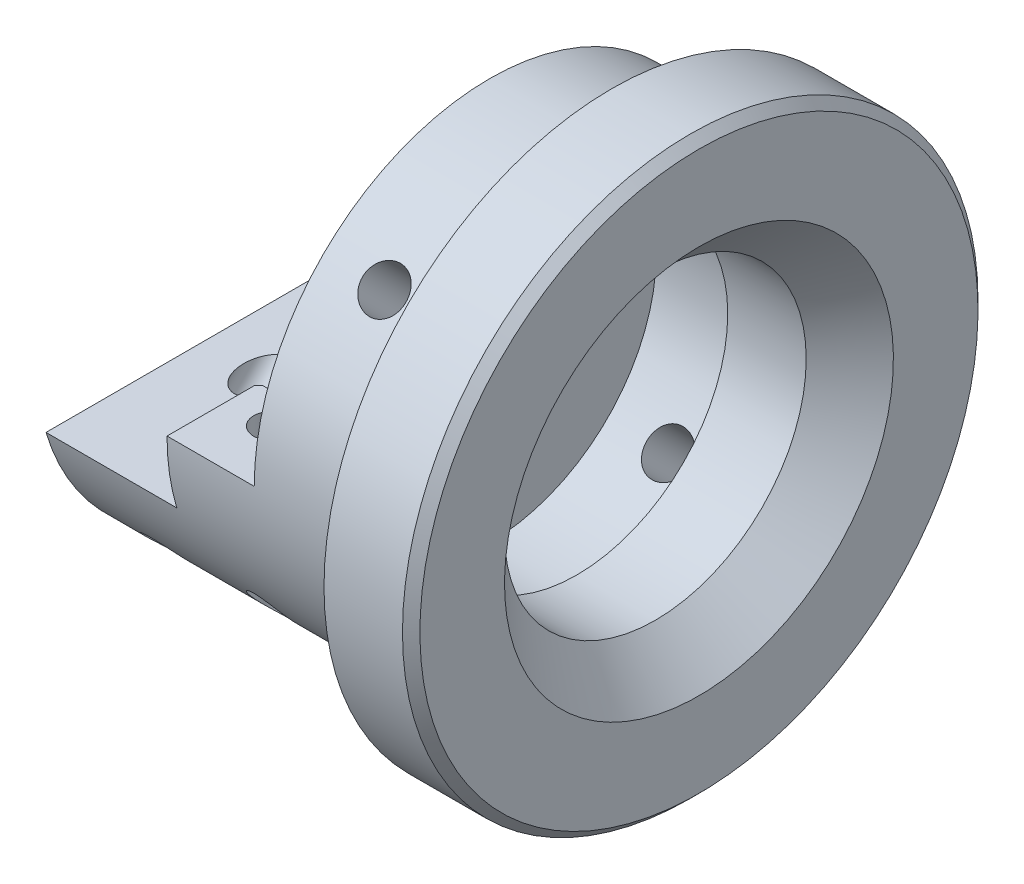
SolidWorks part; units mm, degrees
ref_plane "Vorne" through (0, 0, 0) normal (0, 0, 1) x (1, 0, 0)
ref_plane "Oben" through (0, 0, 0) normal (0, 1, 0) x (1, 0, 0)
ref_plane "Rechts" through (0, 0, 0) normal (1, 0, 0) x (0, 0, -1)
sketch "Skizze1" plane through (0, 0, 0) normal (0, 0, 1) x (1, 0, 0)
  line L0 (139.7, 16.5) -> (144.7, 16.5) construction
  line L1 (139.7, 16.5) -> (139.7, 13.5) construction
  line L2 (81.7, 13.5) -> (139.7, 13.5) construction
  line L3 (144.7, 8.65) -> (132.7, 8.65) construction
  line L4 (144.7, 16.5) -> (144.7, 8.65) construction
  line L5 (132.7, 8.65) -> (132.7, 0) construction
  line L6 (132.7, 0) -> (119.7, 0) construction
  line L9 (119.7, 0) -> (119.7, 13.5) construction
  line L10 (139.7, 16.5) -> (144.7, 16.5)
  line L11 (139.7, 16.5) -> (139.7, 13.5)
  line L12 (119.7, 13.5) -> (139.7, 13.5)
  line L13 (144.7, 8.65) -> (132.7, 8.65)
  line L14 (144.7, 16.5) -> (144.7, 8.65)
  line L15 (132.7, 8.65) -> (132.7, 0)
  line L16 (132.7, 0) -> (119.7, 0)
  line L19 (119.7, 0) -> (119.7, 13.5)
revolve "Rotation1" add sketch "Skizze1" angle 360 about L16
sketch "Skizze20" plane through (0, 0, 0) normal (0, 0, 1) x (1, 0, 0)
  line L0 (119.7, 0) -> (139.7, 0) construction
  line L1 (137.7, 0) -> (132.7, 0)
  line L2 (137.7, 0) -> (137.7, 9.55)
  line L3 (137.7, 9.55) -> (132.7, 9.55)
  line L4 (132.7, 0) -> (132.7, 9.55)
  line L5 (144.7, -16.5) -> (144.7, 16.5) construction
  line L6 (132.7, -8.65) -> (132.7, 8.65) construction
  dimension "D1" = 9.55
  dimension "D2" = 7
revolve "Schnitt-Rotation1" cut sketch "Skizze20" angle 360 about L1
sketch "Skizze2" plane through (0, 0, 0) normal (0, 0, 1) x (1, 0, 0)
  line L0 (132.7, 13.5) -> (132.7, 0)
  line L1 (139.7, 13.5) -> (119.7, 13.5) construction
  line L2 (132.7, 0) -> (119.7, 0)
  line L3 (119.7, 13.5) -> (119.7, -13.5) construction
  line L4 (119.7, 13.5) -> (119.7, 0)
  line L5 (132.7, 13.5) -> (119.7, 13.5)
  dimension "D1" = 13
extrude "Schnitt-Linear austragen1" cut sketch "Skizze2" against normal mid plane 50
sketch "Skizze4" plane through (0, 0, 0) normal (0, 0, 1) x (1, 0, 0)
  line L1 (119.7, 0) -> (127.7, 0)
  line L2 (119.7, 0) -> (119.7, -3.85)
  line L3 (119.7, -3.85) -> (127.7, -3.85)
  line L4 (127.7, 0) -> (127.7, -3.85)
  dimension "D1" = 8
  dimension "D2" = 3.85
extrude "Schnitt-Linear austragen2" cut sketch "Skizze4" against normal mid plane 50
hole_wizard "M2.5 Gewindebohrung1" positions "Skizze6" profile "Skizze5" tap size "M2.5" standard "ISO"
sketch "Skizze6" plane through (0, 0, 0) normal (0, 1, 0) x (-1, 0, 0)
  line L0 (-130.2, -10) -> (-130.2, 10) construction
  line L6 (-127.7, 0) -> (-152.51, 0) construction
  line L7 (-127.7, -13.5) -> (-127.7, 13.5) construction
  line L9 (-127.7, 10) -> (-132.7, 10) construction
  line L10 (-127.7, -13.5) -> (-127.7, 13.5) construction
  line L11 (-132.7, 9.55) -> (-132.7, 13.5) construction
  point P0 (-130.2, 10)
  point P1 (-130.2, -10)
  dimension "D2" = 20
sketch "Skizze5" plane through (130.2, 0, 10) normal (1, 0, 0) x (0, 0, 1)
  line L0 (0, 0) -> (0, 16.5)
  line L1 (0, 16.5) -> (1.025, 16.5)
  line L2 (1.025, 16.5) -> (1.025, 0)
  line L5 (1.025, 0) -> (0, 0)
  line L11 (0, -6.35) -> (0, 107.95) construction
  dimension "Bohrerdurchmesser" = 2.05
  dimension "Bohrungstiefe" = 16.5
ref_plane "Ebene1" through (0, 0, 0) normal (0, 0.7071, -0.7071) x (-1, 0, 0)
ref_plane "Ebene5" through (0, 9.5459, -9.5459) normal (0, 0.7071, -0.7071) x (-1, 0, 0)
ref_plane "Ebene6" through (0, 9.5459, 9.5459) normal (0, 0.7071, 0.7071) x (-1, 0, 0)
hole_wizard "M3 Gewindebohrung1" positions "Skizze8" profile "Skizze7" tap size "M3" standard "ISO"
sketch "Skizze8" plane through (-152.2, 9.5459, -9.5459) normal (0, 0.7071, -0.7071) x (-1, 0, 0)
  line L0 (-289.9, 0) -> (-296.9, 0) construction
  line L1 (-291.9, -13.5) -> (-291.9, 13.5) construction
  point P0 (-288.4, 0)
  dimension "D1" = 3.5
sketch "Skizze7" plane through (136.2, 9.5459, -9.5459) normal (1, 0, 0) x (0, 0.7071, 0.7071)
  line L0 (0, 0) -> (0, 7.2511)
  line L1 (0, 7.2511) -> (1.25, 6.5)
  line L2 (1.25, 6.5) -> (1.25, 0)
  line L5 (1.25, 0) -> (0, 0)
  line L10 (0, 7.2511) -> (-1.25, 6.5) construction
  line L11 (0, -6.35) -> (0, 107.95) construction
  dimension "Bohrerdurchmesser" = 2.5
  dimension "Bohrungstiefe" = 6.5
  dimension "Spitzenwinkel" = 118
mirror "Spiegeln1" about plane through (0, 0, 0) normal (0, 0.7071, -0.7071) of "M3 Gewindebohrung1"
ref_plane "Ebene2" through (0, 0, 0) normal (0, 0.7071, 0.7071) x (1, 0, 0)
hole_wizard "M3 Gewindebohrung3" positions "Skizze12" profile "Skizze11" tap size "M3" standard "ISO"
sketch "Skizze12" plane through (-152.2, 9.5459, 9.5459) normal (0, 0.7071, 0.7071) x (1, 0, 0)
  line L0 (289.9, 0) -> (296.9, 0) construction
  line L1 (291.9, 13.5) -> (291.9, -13.5) construction
  point P0 (288.4, 0)
  dimension "D1" = 3.5
sketch "Skizze11" plane through (136.2, 9.5459, 9.5459) normal (1, 0, 0) x (0, -0.7071, 0.7071)
  line L0 (0, 0) -> (0, 7.2511)
  line L1 (0, 7.2511) -> (1.25, 6.5)
  line L2 (1.25, 6.5) -> (1.25, 0)
  line L5 (1.25, 0) -> (0, 0)
  line L10 (0, 7.2511) -> (-1.25, 6.5) construction
  line L11 (0, -6.35) -> (0, 107.95) construction
  dimension "Bohrerdurchmesser" = 2.5
  dimension "Bohrungstiefe" = 6.5
  dimension "Spitzenwinkel" = 118
ref_plane "Ebene3" through (0, -9.5459, -9.5459) normal (0, -0.7071, -0.7071) x (-1, 0, 0)
hole_wizard "M3 Gewindebohrung5" positions "Skizze16" profile "Skizze15" tap size "M3" standard "ISO"
sketch "Skizze16" plane through (0, -9.5459, -9.5459) normal (0, -0.7071, -0.7071) x (-1, 0, 0)
  line L0 (-127.7, 0) -> (-132.7, 0) construction
  line L2 (-139.7, -13.5) -> (-139.7, 13.5) construction
  point P0 (-123.7, 0)
  dimension "D1" = 16
sketch "Skizze15" plane through (123.7, -9.5459, -9.5459) normal (1, 0, 0) x (0, 0.7071, -0.7071)
  line L0 (0, 0) -> (0, 36.8345)
  line L1 (0, 36.8345) -> (1.25, 36.8345)
  line L2 (1.25, 36.8345) -> (1.25, 0)
  line L5 (1.25, 0) -> (0, 0)
  line L11 (0, -6.35) -> (0, 107.95) construction
  dimension "Bohrerdurchmesser" = 2.5
  dimension "Bohrungstiefe" = 36.8345
ref_plane "Ebene4" through (0, -9.5459, 9.5459) normal (0, -0.7071, 0.7071) x (1, 0, 0)
hole_wizard "M3 Gewindebohrung6" positions "Skizze18" profile "Skizze17" tap size "M3" standard "ISO"
sketch "Skizze18" plane through (0, -9.5459, 9.5459) normal (0, -0.7071, 0.7071) x (1, 0, 0)
  line L0 (123.7, -4.1947) -> (123.7, -13.442) construction
  point P0 (123.7, 0)
sketch "Skizze17" plane through (123.7, -9.5459, 9.5459) normal (1, 0, 0) x (0, -0.7071, -0.7071)
  line L0 (0, 0) -> (0, 36.8345)
  line L1 (0, 36.8345) -> (1.25, 36.8345)
  line L2 (1.25, 36.8345) -> (1.25, 0)
  line L5 (1.25, 0) -> (0, 0)
  line L11 (0, -6.35) -> (0, 107.95) construction
  dimension "Bohrerdurchmesser" = 2.5
  dimension "Bohrungstiefe" = 36.8345
chamfer "Fase1" distance 2.5 angle 45 1 edges at (144.7, 8.65, 0)
chamfer "Fase2" distance 0.5 angle 45 3 edges at (119.7, -3.85, 0) (119.7, -13.5, 0) (144.7, 16.5, 0)
sketch "Skizze21" plane through (119.7, 0, 0) normal (-1, 0, 0) x (0, 0, 1)
  line L0 (-13.5, 0) -> (13.5, 0) construction
  line L1 (0, 0) -> (0, 3.9748) construction
  circle A0 centre (-6.75, 0) radius 1.5
  circle A1 centre (6.75, 0) radius 1.5
  dimension "D1" = 3
  dimension "D2" = 13.5
extrude "Schnitt-Linear austragen3" cut sketch "Skizze21" against normal through all
chamfer "Fase3" distance 0.25 angle 45 4 edges at (132.7, -1.5, 6.75) (127.7, -1.5, 6.75) (132.7, -1.5, -6.75) (127.7, -1.5, -6.75)
mirror "Spiegeln2" about plane through (0, 0, 0) normal (0, 0.7071, 0.7071) of "M3 Gewindebohrung3"
sketch "Skizze22" plane through (119.7, 0, 0) normal (-1, 0, 0) x (0, 0, 1)
  line L0 (-5, 0) -> (5, 0) construction
  circle A0 centre (0, 3) radius 5.5
  dimension "D1" = 11
  dimension "D2" = 2.5
extrude "Schnitt-Linear austragen4" cut sketch "Skizze22" against normal through all
